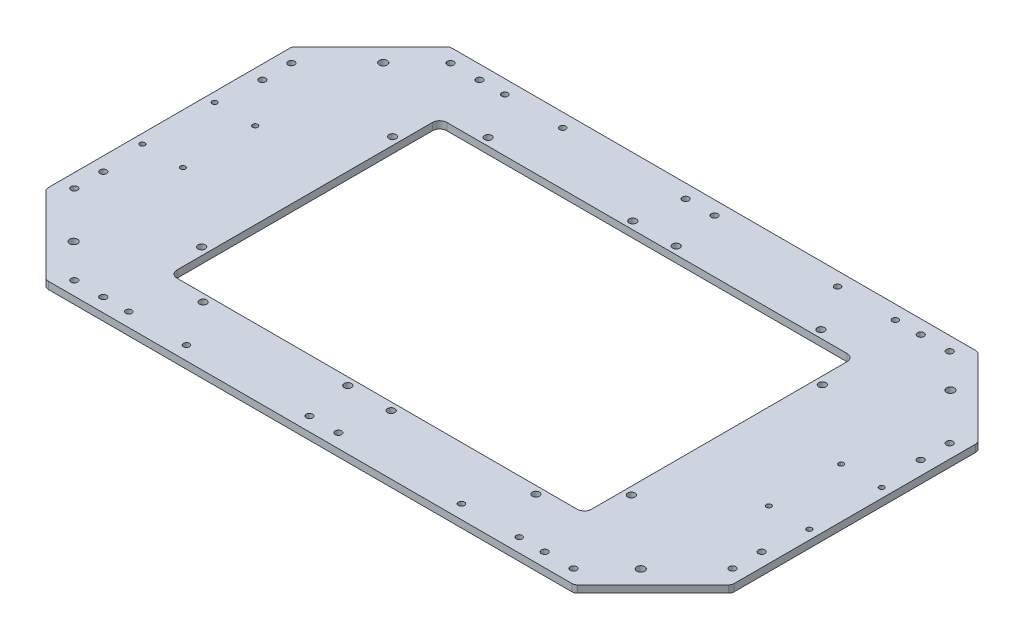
SolidWorks part; units mm, degrees
ref_plane "Ebene vorne" through (0, 0, 0) normal (0, 0, 1) x (1, 0, 0)
ref_plane "Ebene oben" through (0, 0, 0) normal (0, 1, 0) x (1, 0, 0)
ref_plane "Ebene rechts" through (0, 0, 0) normal (1, 0, 0) x (0, 0, -1)
sketch "Skizze1" plane through (0, 0, 0) normal (0, 1, 0) x (1, 0, 0)
  line L0 (-366, 281) -> (-476, 171)
  line L1 (-366, -281) -> (366, -281)
  line L2 (-366, -281) -> (-366, 281) construction
  line L3 (-366, 281) -> (366, 281)
  line L4 (366, -281) -> (366, 281) construction
  line L5 (-366, -281) -> (366, 281) construction
  line L6 (-366, 281) -> (366, -281) construction
  line L7 (-476, 171) -> (-476, -171)
  line L8 (-476, -171) -> (-366, -281)
  line L9 (366, -281) -> (476, -171)
  line L10 (476, -171) -> (476, 171)
  line L11 (476, 171) -> (366, 281)
  line L12 (-662.0681, 0) -> (0, 0) construction
  line L13 (0, 0) -> (684.1196, 0) construction
  line L14 (-53.5395, 0) -> (53.5395, 0) construction
  point P0 (0, 0)
  dimension "D1" = 732
  dimension "D2" = 562
  dimension "D3" = 45
  dimension "D4" = 110
extrude "Aufsatz-Linear austragen1" add sketch "Skizze1" along normal blind 10
hole_wizard "Durchgangsloch für M81" positions "Skizze2" profile "Skizze3" hole size "M8" standard "DIN"
sketch "Skizze2" plane through (0, 10, 0) normal (0, 1, 0) x (1, 0, 0)
  line L1 (345, -260) -> (-345, -260)
  line L2 (345, -260) -> (345, 260)
  line L3 (345, 260) -> (-345, 260)
  line L4 (-345, -260) -> (-345, 260)
  line L5 (345, -260) -> (-345, 260) construction
  line L6 (345, 260) -> (-345, -260) construction
  line L8 (0, 0) -> (0, 387.6038) construction
  line L10 (-455, 150) -> (-455, 110) construction
  line L11 (-455, 110) -> (-455, -110) construction
  line L12 (-455, -110) -> (-455, -150) construction
  line L14 (-455, 0) -> (0, 0) construction
  line L17 (455, -110) -> (455, -150) construction
  line L18 (455, 110) -> (455, -110) construction
  line L19 (455, 150) -> (455, 110) construction
  point P2 (-345, 260)
  point P5 (345, -260)
  point P6 (345, 260)
  point P7 (-345, -260)
  point P63 (-305, 260)
  point P65 (-305, -260)
  point P67 (305, -260)
  point P69 (305, 260)
  point P79 (-455, 150)
  point P81 (-455, 110)
  point P83 (-455, -110)
  point P85 (-455, -150)
  point P108 (455, 150)
  point P111 (455, 110)
  point P114 (455, -110)
  point P117 (455, -150)
  point P122 (-20, 260)
  point P124 (20, 260)
  point P126 (-20, -260)
  point P128 (20, -260)
  dimension "D1" = 520
  dimension "D2" = 690
  dimension "D3" = 40
  dimension "D4" = 40
  dimension "D5" = 910
  dimension "D6" = 300
  dimension "D7" = 40
sketch "Skizze3" plane through (-345, 10, -260) normal (1, 0, 0) x (0, 0, 1)
  line L0 (0, 0) -> (0, 10)
  line L1 (0, 10) -> (4.5, 10)
  line L2 (4.5, 10) -> (4.5, 0)
  line L5 (4.5, 0) -> (0, 0)
  line L11 (0, -6.35) -> (0, 107.95) construction
  dimension "Bohrerdurchmesser" = 9
  dimension "Bohrungstiefe" = 10
fillet "Verrundung1" radius 10
sketch "Skizze4" plane through (0, 10, 0) normal (0, 1, 0) x (1, 0, 0)
  line L16 (-367.5147, 276.6569) -> (-471.6569, 172.5147)
  line L17 (-474, 166.8579) -> (-474, -166.8579)
  line L18 (-471.6569, -172.5147) -> (-367.5147, -276.6569)
  line L19 (-361.8579, -279) -> (361.8579, -279)
  line L20 (367.5147, -276.6569) -> (471.6569, -172.5147)
  line L21 (474, -166.8579) -> (474, 166.8579)
  line L22 (471.6569, 172.5147) -> (367.5147, 276.6569)
  line L23 (361.8579, 279) -> (-361.8579, 279)
  line L24 (-367.5147, 276.6569) -> (-471.6569, 172.5147)
  line L25 (-474, 166.8579) -> (-474, -166.8579)
  line L26 (-471.6569, -172.5147) -> (-367.5147, -276.6569)
  line L27 (-361.8579, -279) -> (361.8579, -279)
  line L28 (367.5147, -276.6569) -> (471.6569, -172.5147)
  line L29 (474, -166.8579) -> (474, 166.8579)
  line L30 (471.6569, 172.5147) -> (367.5147, 276.6569)
  line L31 (361.8579, 279) -> (-361.8579, 279)
  line L32 (-368.9289, 278.0711) -> (-473.0711, 173.9289)
  line L33 (-476, 166.8579) -> (-476, -166.8579)
  line L34 (-473.0711, -173.9289) -> (-368.9289, -278.0711)
  line L35 (-361.8579, -281) -> (361.8579, -281)
  line L36 (368.9289, -278.0711) -> (473.0711, -173.9289)
  line L37 (476, -166.8579) -> (476, 166.8579)
  line L38 (473.0711, 173.9289) -> (368.9289, 278.0711)
  line L39 (361.8579, 281) -> (-361.8579, 281)
  line L40 (-368.9289, 278.0711) -> (-473.0711, 173.9289)
  line L41 (-476, 166.8579) -> (-476, -166.8579)
  line L42 (-473.0711, -173.9289) -> (-368.9289, -278.0711)
  line L43 (-361.8579, -281) -> (361.8579, -281)
  line L44 (368.9289, -278.0711) -> (473.0711, -173.9289)
  line L45 (476, -166.8579) -> (476, 166.8579)
  line L46 (473.0711, 173.9289) -> (368.9289, 278.0711)
  line L47 (361.8579, 281) -> (-361.8579, 281)
  arc A16 (-471.6569, 172.5147) -> (-474, 166.8579) centre (-466, 166.8579) ccw
  arc A17 (-474, -166.8579) -> (-471.6569, -172.5147) centre (-466, -166.8579) ccw
  arc A18 (-367.5147, -276.6569) -> (-361.8579, -279) centre (-361.8579, -271) ccw
  arc A19 (361.8579, -279) -> (367.5147, -276.6569) centre (361.8579, -271) ccw
  arc A20 (471.6569, -172.5147) -> (474, -166.8579) centre (466, -166.8579) ccw
  arc A21 (474, 166.8579) -> (471.6569, 172.5147) centre (466, 166.8579) ccw
  arc A22 (367.5147, 276.6569) -> (361.8579, 279) centre (361.8579, 271) ccw
  arc A23 (-361.8579, 279) -> (-367.5147, 276.6569) centre (-361.8579, 271) ccw
  arc A24 (-471.6569, 172.5147) -> (-474, 166.8579) centre (-466, 166.8579) ccw
  arc A25 (-474, -166.8579) -> (-471.6569, -172.5147) centre (-466, -166.8579) ccw
  arc A26 (-367.5147, -276.6569) -> (-361.8579, -279) centre (-361.8579, -271) ccw
  arc A27 (361.8579, -279) -> (367.5147, -276.6569) centre (361.8579, -271) ccw
  arc A28 (471.6569, -172.5147) -> (474, -166.8579) centre (466, -166.8579) ccw
  arc A29 (474, 166.8579) -> (471.6569, 172.5147) centre (466, 166.8579) ccw
  arc A30 (367.5147, 276.6569) -> (361.8579, 279) centre (361.8579, 271) ccw
  arc A31 (-361.8579, 279) -> (-367.5147, 276.6569) centre (-361.8579, 271) ccw
  arc A32 (-473.0711, 173.9289) -> (-476, 166.8579) centre (-466, 166.8579) ccw
  arc A33 (-476, -166.8579) -> (-473.0711, -173.9289) centre (-466, -166.8579) ccw
  arc A34 (-368.9289, -278.0711) -> (-361.8579, -281) centre (-361.8579, -271) ccw
  arc A35 (361.8579, -281) -> (368.9289, -278.0711) centre (361.8579, -271) ccw
  arc A36 (473.0711, -173.9289) -> (476, -166.8579) centre (466, -166.8579) ccw
  arc A37 (476, 166.8579) -> (473.0711, 173.9289) centre (466, 166.8579) ccw
  arc A38 (368.9289, 278.0711) -> (361.8579, 281) centre (361.8579, 271) ccw
  arc A39 (-361.8579, 281) -> (-368.9289, 278.0711) centre (-361.8579, 271) ccw
  arc A40 (-473.0711, 173.9289) -> (-476, 166.8579) centre (-466, 166.8579) ccw
  arc A41 (-476, -166.8579) -> (-473.0711, -173.9289) centre (-466, -166.8579) ccw
  arc A42 (-368.9289, -278.0711) -> (-361.8579, -281) centre (-361.8579, -271) ccw
  arc A43 (361.8579, -281) -> (368.9289, -278.0711) centre (361.8579, -271) ccw
  arc A44 (473.0711, -173.9289) -> (476, -166.8579) centre (466, -166.8579) ccw
  arc A45 (476, 166.8579) -> (473.0711, 173.9289) centre (466, 166.8579) ccw
  arc A46 (368.9289, 278.0711) -> (361.8579, 281) centre (361.8579, 271) ccw
  arc A47 (-361.8579, 281) -> (-368.9289, 278.0711) centre (-361.8579, 271) ccw
  dimension "D1" = 2
  dimension "D2" = 0
extrude "Schnitt-Linear austragen1" cut sketch "Skizze4" against normal through all
hole_wizard "Durchgangsloch für M101" positions "Skizze5" profile "Skizze6" hole size "M10" standard "DIN"
sketch "Skizze5" plane through (0, 10, 0) normal (0, 1, 0) x (1, 0, 0)
  line L1 (392, -214) -> (-392, -214)
  line L2 (392, -214) -> (392, 214)
  line L3 (392, 214) -> (-392, 214)
  line L4 (-392, -214) -> (-392, 214)
  line L5 (392, -214) -> (-392, 214) construction
  line L6 (392, 214) -> (-392, -214) construction
  line L7 (474, -166.8579) -> (474, 166.8579) construction
  line L8 (361.8579, 279) -> (-361.8579, 279) construction
  point P2 (-392, 214)
  point P5 (392, -214)
  point P6 (392, 214)
  point P7 (-392, -214)
  dimension "D1" = 65
  dimension "D2" = 82
sketch "Skizze6" plane through (-392, 10, -214) normal (1, 0, 0) x (0, 0, 1)
  line L0 (0, 0) -> (0, 10)
  line L1 (0, 10) -> (5.5, 10)
  line L2 (5.5, 10) -> (5.5, 0)
  line L5 (5.5, 0) -> (0, 0)
  line L11 (0, -6.35) -> (0, 107.95) construction
  dimension "Bohrerdurchmesser" = 11
  dimension "Bohrungstiefe" = 10
hole_wizard "Ø7.0 (7) Durchmesser Bohrung1" positions "Skizze7" profile "Skizze8" hole size "Ø7.0" standard "DIN"
sketch "Skizze7" plane through (0, 10, 0) normal (0, 1, 0) x (1, 0, 0)
  line L0 (-485.7819, 0) -> (0, 0) construction
  line L1 (0, 0) -> (0, 334.5577) construction
  line L2 (0, -53.599) -> (0, 53.599) construction
  point P0 (-461, 50)
  point P2 (-405, 50)
  point P4 (-405, -50)
  point P6 (-461, -50)
  point P20 (461, -50)
  point P21 (405, -50)
  point P22 (405, 50)
  point P23 (461, 50)
  dimension "D1" = 56
  dimension "D2" = 100
  dimension "D3" = 405
sketch "Skizze8" plane through (-461, 10, -50) normal (1, 0, 0) x (0, 0, 1)
  line L0 (0, 0) -> (0, 14.103)
  line L1 (0, 14.103) -> (3.5, 12)
  line L2 (3.5, 12) -> (3.5, 0)
  line L5 (3.5, 0) -> (0, 0)
  line L10 (0, 14.103) -> (-3.5, 12) construction
  line L11 (0, -6.35) -> (0, 107.95) construction
  dimension "Bohrerdurchmesser" = 7
  dimension "Bohrungstiefe" = 12
  dimension "Spitzenwinkel" = 118
sketch "Skizze9" plane through (0, 10, 0) normal (0, 1, 0) x (1, 0, 0)
  line L1 (-276.5, -186.5) -> (276.5, -186.5)
  line L2 (-286.5, -176.5) -> (-286.5, 176.5)
  line L3 (-276.5, 186.5) -> (276.5, 186.5)
  line L4 (286.5, -176.5) -> (286.5, 176.5)
  line L5 (-286.5, -186.5) -> (286.5, 186.5) construction
  line L6 (-286.5, 186.5) -> (286.5, -186.5) construction
  arc A0 (-276.5, 186.5) -> (-286.5, 176.5) centre (-276.5, 176.5) ccw
  arc A1 (286.5, 176.5) -> (276.5, 186.5) centre (276.5, 176.5) ccw
  arc A2 (-276.5, -186.5) -> (-286.5, -176.5) centre (-276.5, -176.5) cw
  arc A3 (286.5, -176.5) -> (276.5, -186.5) centre (276.5, -176.5) cw
  point P0 (0, 0)
  dimension "D3" = 10
  dimension "D1" = 573
  dimension "D2" = 373
extrude "Schnitt-Linear austragen2" cut sketch "Skizze9" against normal through all
sketch "Skizze10" plane through (0, 10, 0) normal (0, 1, 0) x (1, 0, 0)
  line L0 (-297, 132) -> (-297, -132) construction
  line L1 (-297, -132) -> (297, -132) construction
  line L2 (297, -132) -> (297, 132) construction
  line L3 (-297, 132) -> (297, 132) construction
  line L4 (-230, 197) -> (-230, -197) construction
  line L5 (-230, -197) -> (230, -197) construction
  line L6 (230, -197) -> (230, 197) construction
  line L7 (230, 197) -> (-230, 197) construction
  line L10 (276.5, 186.5) -> (-276.5, 186.5) construction
  line L11 (-286.5, 176.5) -> (-286.5, -176.5) construction
  line L13 (286.5, -176.5) -> (286.5, 176.5) construction
  line L14 (-276.5, -186.5) -> (276.5, -186.5) construction
  line L15 (0, -53.599) -> (0, 53.599) construction
  line L16 (-30, 197) -> (-30, -197) construction
  line L17 (30, 197) -> (30, -197) construction
  dimension "D1" = 54.5
  dimension "D2" = 10.5
  dimension "D3" = 10.5
  dimension "D4" = 54.5
  dimension "D5" = 230
  dimension "D6" = 230
  dimension "D7" = 10.5
  dimension "D8" = 10.5
  dimension "D9" = 30
  dimension "D10" = 30
hole_wizard "Ø10.0 (10) Durchmesser Bohrung1" positions "3D-Skizze1" profile "Skizze11" hole size "Ø10.0" standard "DIN"
sketch3d "3D-Skizze1"
  point P0 (-297, 10, -132)
  point P3 (-230, 10, -197)
  point P6 (-30, 10, -197)
  point P9 (30, 10, -197)
  point P12 (230, 10, -197)
  point P15 (297, 10, -132)
  point P18 (297, 10, 132)
  point P21 (230, 10, 197)
  point P24 (30, 10, 197)
  point P27 (-30, 10, 197)
  point P30 (-230, 10, 197)
  point P33 (-297, 10, 132)
sketch "Skizze11" plane through (-297, 10, -132) normal (1, 0, 0) x (0, 0, 1)
  line L0 (0, 0) -> (0, 10)
  line L1 (0, 10) -> (5, 10)
  line L2 (5, 10) -> (5, 0)
  line L5 (5, 0) -> (0, 0)
  line L11 (0, -6.35) -> (0, 107.95) construction
  dimension "Bohrerdurchmesser" = 10
  dimension "Bohrungstiefe" = 10
sketch "Skizze12" plane through (0, 10, 0) normal (0, 1, 0) x (1, 0, 0)
  line L0 (-270, -260) -> (-190, -260) construction
  line L1 (190, -260) -> (270, -260) construction
  line L4 (0, -53.599) -> (0, 53.599) construction
  line L5 (-361.8579, -279) -> (361.8579, -279) construction
  dimension "D1" = 80
  dimension "D2" = 80
  dimension "D3" = 19
  dimension "D4" = 190
  dimension "D5" = 190
hole_wizard "Durchgangsloch für M82" positions "3D-Skizze2" profile "Skizze13" hole size "M8" standard "DIN"
sketch3d "3D-Skizze2"
  point P0 (-270, 10, 260)
  point P3 (-190, 10, 260)
  point P6 (190, 10, 260)
  point P9 (270, 10, 260)
sketch "Skizze13" plane through (-270, 10, 260) normal (1, 0, 0) x (0, 0, 1)
  line L0 (0, 0) -> (0, 10)
  line L1 (0, 10) -> (4.2, 10)
  line L2 (4.2, 10) -> (4.2, 0)
  line L5 (4.2, 0) -> (0, 0)
  line L11 (0, -6.35) -> (0, 107.95) construction
  dimension "Bohrerdurchmesser" = 8.4
  dimension "Bohrungstiefe" = 10
mirror "Spiegeln1" about plane through (0, 0, 0) normal (0, 0, 1) of "Durchgangsloch für M82"
